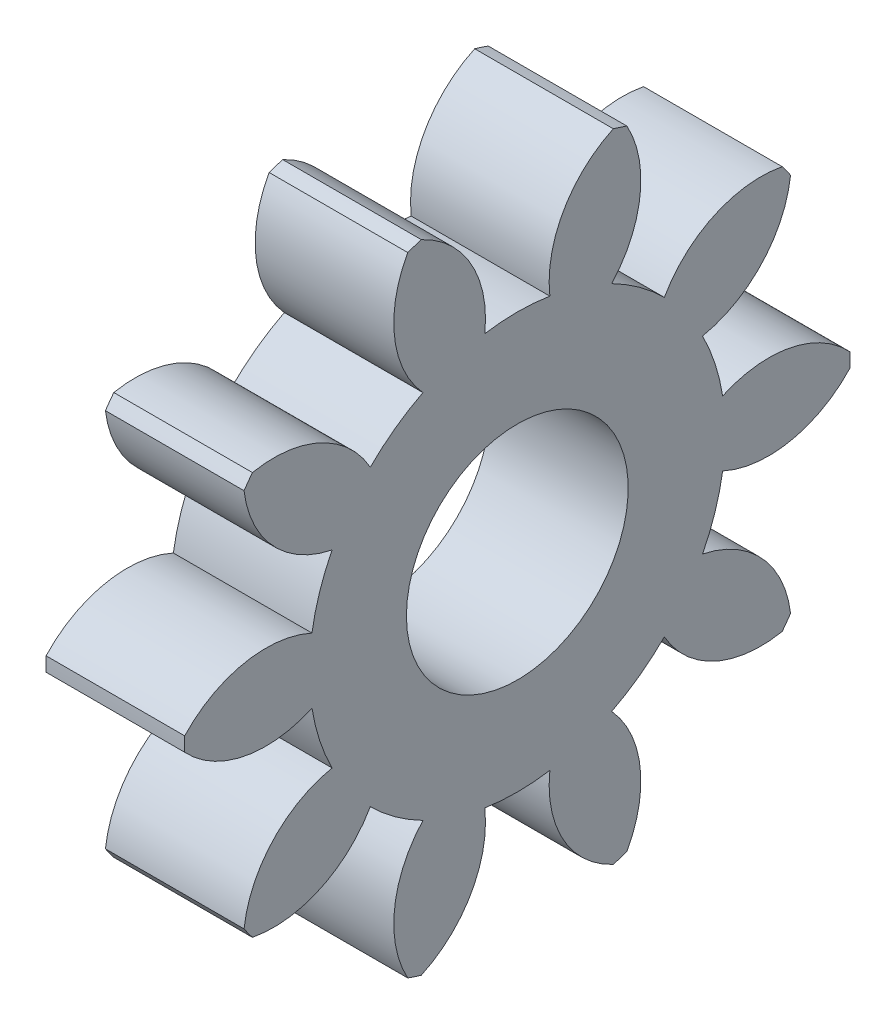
SolidWorks part; units mm, degrees
ref_plane "Plane1" through (0, 0, 0) normal (0, 0, 1) x (1, 0, 0)
ref_plane "Plane2" through (0, 0, 0) normal (0, 1, 0) x (1, 0, 0)
ref_plane "Plane3" through (0, 0, 0) normal (1, 0, 0) x (0, 0, -1)
sketch "HoldingSke" plane through (0, 0, 0) normal (0, 1, 0) x (1, 0, 0)
  line L0 (0, 0) -> (0.4924, -0.0868)
  line L1 (-15, 0) -> (100, 0) construction
  line L2 (0, 0) -> (-2.1039, 2.3779)
  line L3 (0, 0) -> (-11.863, 4.5341)
  line L4 (0, 0) -> (8.5048, 1.4996)
  line L5 (0, 0) -> (-46.8476, -17.4728)
  line L6 (0, 0) -> (-4.1448, -2.7965)
  line L7 (-2.1039, 2.3779) -> (8.6586, 51.2059)
  line L8 (-76.2, 54.61) -> (-74.8, 54.61)
  line L9 (-71.009, 38.7566) -> (-53.1078, 45.2721)
  line L10 (-76.2, 71.12) -> (104.1128, 71.12)
  line L11 (0, 0) -> (-5, 0)
  line L12 (-76.2, 101.6) -> (-76.133, 101.6)
  line L13 (24.9733, 27.94) -> (52.9518, 28.4284)
  line L14 (24.9733, 27.94) -> (24.9743, 27.94)
  line L15 (24.9733, 27.94) -> (100.4006, 29.5858)
  line L16 (-63.627, -2) -> (-12.827, -2)
  circle A0 centre (0, 0) radius 4
  circle A1 centre (0, 0) radius 7.499
  circle A2 centre (0, 0) radius 37.5
  circle A3 centre (0, 0) radius 4
sketch "BasProSke" plane through (0, 0, 0) normal (0, 1, 0) x (1, 0, 0)
  line L0 (-10, 0) -> (60, 0) construction
  line L1 (0, 0) -> (0, 12)
  line L2 (0, 0) -> (5, 0)
  line L3 (5, 0) -> (5, 12)
  line L4 (5, 12) -> (0, 12)
revolve "Base-Revolve" add sketch "BasProSke" angle 360 about L0
sketch "TooCutSke" plane through (0, 0, 0) normal (1, 0, 0) x (0, 0, -1)
  line L1 (0, 0) -> (0, 107) construction
  line L2 (0, 0) -> (-1.6814, 9.8576) construction
  line L3 (0, 0) -> (-6.1153, 18.8209) construction
  line L4 (-1.6814, 9.8576) -> (-3.0576, 9.4105) construction
  arc A0 (1.1737, 7.4066) -> (-1.1737, 7.4066) centre (0, 0) ccw
  arc A1 (3.4979, 11.5054) -> (-3.4979, 11.5054) centre (0, 0) ccw
  circle A2 centre (0, 0) radius 10 construction
  circle A3 centre (0, 0) radius 9.3969 construction
  arc A4 (-1.1737, 7.4066) -> (-3.4979, 11.5054) centre (-5.1477, 7.8615) ccw
  arc A5 (3.4979, 11.5054) -> (1.1737, 7.4066) centre (5.1477, 7.8615) ccw
extrude "ToothCut" cut sketch "TooCutSke" along normal through all
fillet "Breaks" [suppressed] radius 0.04
fillet "RootFillets" [suppressed] radius 0.501
pattern_circular "TeethCuts" count 10 every 36 about axis through (-10, 0, 0) along (1, 0, 0) of "ToothCut", "RootFillets", "Breaks"
sketch "HubNeaOneSke" plane through (0, 0, 0) normal (-1, 0, 0) x (0, 0, 1)
  circle A0 centre (0, 0) radius 7.499
extrude "HubNearOne" [suppressed] add sketch "HubNeaOneSke" along normal blind 45.0001
sketch "HubNeaBotSke" plane through (0, 0, 0) normal (-1, 0, 0) x (0, 0, 1)
  circle A0 centre (0, 0) radius 7.499
extrude "HubNearBoth" [suppressed] add sketch "HubNeaBotSke" along normal blind 22.5
ref_plane "FarPln" through (5, 0, 0) normal (1, 0, 0) x (0, 0, -1)
sketch "HubFarSke" plane through (5, 0, 0) normal (1, 0, 0) x (0, 0, -1)
  circle A0 centre (0, 0) radius 7.499
extrude "HubFar" [suppressed] add sketch "HubFarSke" along normal blind 22.5
sketch "BorSke" plane through (0, 0, 0) normal (1, 0, 0) x (0, 0, -1)
  circle A0 centre (0, 0) radius 4
extrude "Bore" cut sketch "BorSke" along normal mid plane 100.0001
sketch "KeySke" plane through (0, 0, 0) normal (1, 0, 0) x (0, 0, -1)
  line L0 (-1.5, 0) -> (-1.5, 5.4)
  line L1 (-1.5, 5.4) -> (1.5, 5.4)
  line L2 (1.5, 5.4) -> (1.5, 0)
  line L3 (0, 0) -> (0, 34) construction
  line L4 (-1.5, 0) -> (1.5, 0)
extrude "Keyway" [suppressed] cut sketch "KeySke" along normal mid plane 100.0001
pattern_circular "Keyway2" [suppressed] count 2 every 90 about axis through (-10, 0, 0) along (1, 0, 0)
equation "' \"Module@HoldingSke\" = 6.35"
equation "' \"Num_teeth@HoldingSke\" = 12"
equation "' \"Ap@HoldingSke\" =  20"
equation "' \"Ap@HoldingSke\" = 20"
equation "' \"Width@HoldingSke\" = 0.5 * 25.4"
equation "' \"Hub_dia@HoldingSke\"= 1 * 25.4"
equation "' \"Hub_dia@HoldingSke\" = 1 * 25.4"
equation "' \"Overall_len@HoldingSke\" = 1.0 * 25.4"
equation "' \"Bore@HoldingSke\" = 0.75 * 25.4"
equation "' \"T_dim@HoldingSke\" = 0.1 * 25.4"
equation "' \"Width@KeySke\" = 0.25 * 25.4"
equation "' \"Show_teeth@HoldingSke\" = 13"
equation "' \"Backlash@HoldingSke\" = 0.009 * 25.4"
equation "' \"Addendum_fac@HoldingSke\" = 1.0"
equation "' \"Dedendum_fac@HoldingSke\" = 1.25"
equation "' \"Dedendum_add@HoldingSke\" = 0.00005 * 25.4"
equation "' \"Clearance_fac@HoldingSke\" = 0.25"
equation "\"Pitch@HoldingSke\" = 1 / \"Module@HoldingSke\""
equation "\"Overcut_dia@TooCutSke\" = (\"Num_teeth@HoldingSke\" + 2 * \"Addendum_fac@HoldingSke\") / \"Pitch@HoldingSke\" + 0.002 * 25.4"
equation "\"Pitch_dia@TooCutSke\" = \"Num_teeth@HoldingSke\" / \"Pitch@HoldingSke\""
equation "\"Base_dia@TooCutSke\" = \"Num_teeth@HoldingSke\" / \"Pitch@HoldingSke\" * cos((\"Ap@HoldingSke\"  * 3.14159265 / 180))"
equation "\"Root_dia@TooCutSke\" = (\"Num_teeth@HoldingSke\" + 2) / \"Pitch@HoldingSke\" - 2 * (\"Addendum_fac@HoldingSke\" + \"Dedendum_fac@HoldingSke\") / \"Pitch@HoldingSke\" - \"Dedendum_add@HoldingSke\" * 2"
equation "\"Half_ang@TooCutSke\" = 180 / \"Num_teeth@HoldingSke\""
equation "\"Half_CT@TooCutSke\" = \"Num_teeth@HoldingSke\" / \"Pitch@HoldingSke\" * sin((3.14159265 / 2 / \"Num_teeth@HoldingSke\")) / 2 - 7 * \"Backlash@HoldingSke\" / 4"
equation "\"Flank_rad@TooCutSke\" = \"Num_teeth@HoldingSke\" / \"Pitch@HoldingSke\" / 5"
equation "\"Radius@RootFillets\" = \"Clearance_fac@HoldingSke\" / \"Pitch@HoldingSke\" + \"Dedendum_add@HoldingSke\""
equation "\"Break_rad@Breaks\" = 0.02 / \"Pitch@HoldingSke\""
equation "\"Thickness@HoldingSke\" = \"Width@HoldingSke\""
equation "\"OAL@HoldingSke\" = \"Thickness@HoldingSke\""
equation "\"MHD@HoldingSke\" = (\"Num_teeth@HoldingSke\" + 2) / \"Pitch@HoldingSke\" - 2 * (\"Addendum_fac@HoldingSke\" + \"Dedendum_fac@HoldingSke\")  / \"Pitch@HoldingSke\" - \"Dedendum_add@HoldingSke\" * 2"
equation "\"MBD@HoldingSke\" = (\"Num_teeth@HoldingSke\" + 2) / \"Pitch@HoldingSke\" - 2 * (\"Addendum_fac@HoldingSke\" + \"Dedendum_fac@HoldingSke\")  / \"Pitch@HoldingSke\" - \"Dedendum_add@HoldingSke\" * 2 - 0.002 * 25.4"
equation "\"MHD@HoldingSke\" = ((sgn( \"MHD@HoldingSke\" - \"Hub_dia@HoldingSke\" )-1)*( \"MHD@HoldingSke\" - \"Hub_dia@HoldingSke\" ))/-2+ \"Hub_dia@HoldingSke\""
equation "\"MBD@HoldingSke\" = ((sgn( \"MBD@HoldingSke\" - \"Bore@HoldingSke\" )-1)*( \"MBD@HoldingSke\" - \"Bore@HoldingSke\" ))/-2+ \"Bore@HoldingSke\""
equation "\"OAL@HoldingSke\" = ((sgn( \"OAL@HoldingSke\" - \"Overall_len@HoldingSke\" )+1)*( \"OAL@HoldingSke\" - \"Overall_len@HoldingSke\" ))/2 + \"Overall_len@HoldingSke\" + 0.000002 * 25.4"
equation "\"Num_teeth@TeethCuts\" = int( \"Show_teeth@HoldingSke\" ) + 1"
equation "\"Num_teeth@TeethCuts\" = ((sgn( \"Num_teeth@TeethCuts\" - \"Num_teeth@HoldingSke\" )-1)*( \"Num_teeth@TeethCuts\" - \"Num_teeth@HoldingSke\" ))/-2+ \"Num_teeth@HoldingSke\""
equation "\"Num_teeth@TeethCuts\" = ((sgn( \"Num_teeth@TeethCuts\" - 2.0)+1)*( \"Num_teeth@TeethCuts\" - 2.0))/2 +2.0"
equation "\"Angle@TeethCuts\" = 360.0 / \"Num_teeth@HoldingSke\""
equation "\"Diameter@BasProSke\" = (\"Num_teeth@HoldingSke\" + 2 * \"Addendum_fac@HoldingSke\") / \"Pitch@HoldingSke\""
equation "\"Thickness@BasProSke\"  = \"Thickness@HoldingSke\""
equation "' \"Fillet_rad@BasProSke\" =  \"Thickness@HoldingSke\" * 0.05"
equation "' \"Fillet_rad@BasProSke\" = \"Thickness@HoldingSke\" * 0.05"
equation "\"MHD@HoldingSke\" = ((sgn( \"MHD@HoldingSke\" - \"Root_dia@TooCutSke\" )-1)*( \"MHD@HoldingSke\" - \"Root_dia@TooCutSke\" ))/-2+ \"Root_dia@TooCutSke\""
equation "\"Diameter@HubNeaOneSke\" = \"MHD@HoldingSke\""
equation "\"Length@HubNearOne\" = \"OAL@HoldingSke\" - \"Thickness@BasProSke\""
equation "\"Diameter@HubNeaBotSke\" = \"MHD@HoldingSke\""
equation "\"Length@HubNearBoth\" = ( \"OAL@HoldingSke\" - \"Thickness@BasProSke\" ) / 2.0"
equation "\"Thickness@FarPln\" = \"Thickness@BasProSke\""
equation "\"Diameter@HubFarSke\" = \"MHD@HoldingSke\""
equation "\"Length@HubFar\" = ( \"OAL@HoldingSke\" - \"Thickness@BasProSke\" ) / 2.0"
equation "\"Diameter@BorSke\" = \"MBD@HoldingSke\""
equation "\"D1@Bore\" = \"OAL@HoldingSke\" * 2.0"
equation "\"D1@Keyway\" = \"OAL@HoldingSke\" * 2.0"
equation "\"Offset@KeySke\" = \"T_dim@HoldingSke\" + \"MBD@HoldingSke\" / 2.0"
